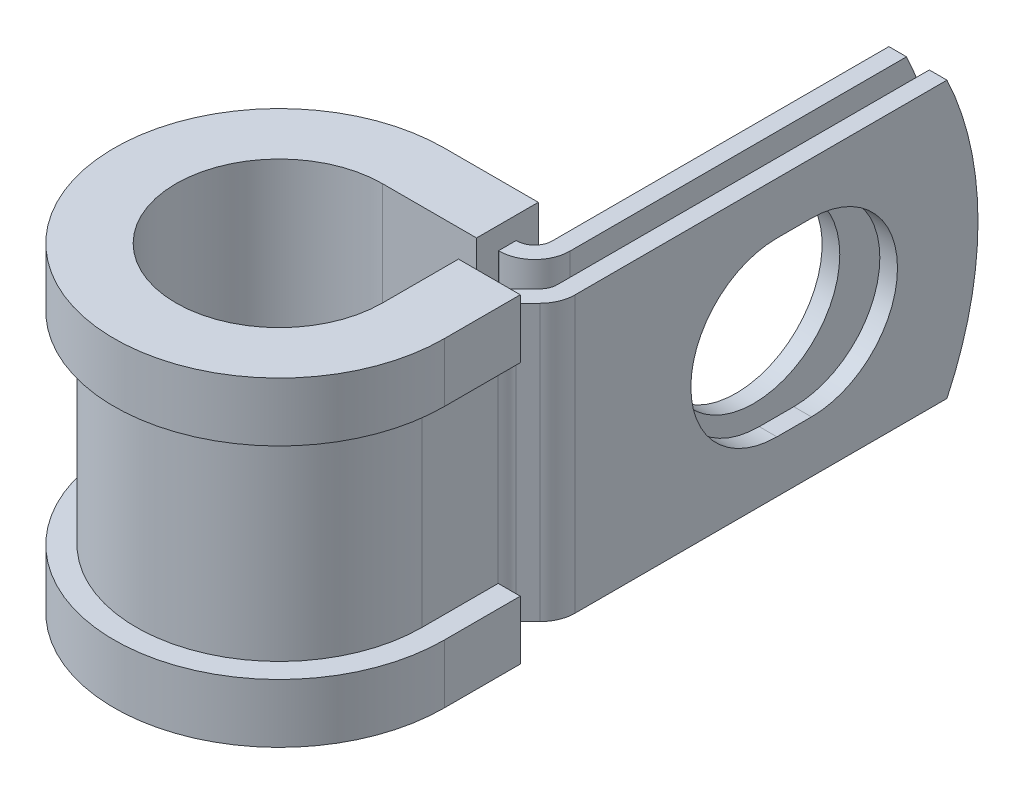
SolidWorks part; units mm, degrees
ref_plane "Front Plane" through (0, 0, 0) normal (0, 0, 1) x (1, 0, 0)
ref_plane "Top Plane" through (0, 0, 0) normal (0, 1, 0) x (1, 0, 0)
ref_plane "Right Plane" through (0, 0, 0) normal (1, 0, 0) x (0, 0, -1)
sketch "Sketch1" plane through (0, 0, 0) normal (0, 1, 0) x (1, 0, 0)
  line L0 (0, 8.6614) -> (6.5457, 8.6614)
  line L1 (8.6614, 0) -> (8.6614, 5.2489)
  line L2 (8.9841, 36.4998) -> (8.9841, 11.0998)
  line L3 (9.3756, 6.9731) -> (10.2018, 7.7993)
  line L5 (10.5589, 8.6614) -> (10.5589, 36.4998)
  arc A0 (0, 8.6614) -> (8.6614, 0) centre (0, 0) ccw
  arc A1 (9.3756, 6.9731) -> (8.6614, 5.2489) centre (11.0998, 5.2489) ccw
  arc A2 (10.2018, 7.7993) -> (10.5589, 8.6614) centre (9.3397, 8.6614) ccw
  arc A3 (6.5457, 8.6614) -> (8.9841, 11.0998) centre (6.5457, 11.0998) ccw
extrude "Extrude-Thin1" add sketch "Sketch1" along normal mid plane 19.05 thin
sketch "Sketch2" plane through (7.7649, 0, 0) normal (-1, 0, 0) x (0, 0, 1)
  line L0 (-36.4998, 9.525) -> (-36.4998, -9.525) construction
  line L1 (0, 9.525) -> (0, -9.525) construction
  circle A0 centre (-23.7998, 0) radius 5.9436
  point P2 (-36.4998, 0)
extrude "Cut-Extrude1" cut sketch "Sketch2" against normal up to surface (1.2192 mm away)
sketch "Sketch3" plane through (11.7781, 0, 0) normal (1, 0, 0) x (0, 0, -1)
  line L0 (22.606, 0) -> (24.9936, 0) construction
  line L1 (22.606, 5.9436) -> (24.9936, 5.9436)
  line L2 (22.606, -5.9436) -> (24.9936, -5.9436)
  line L3 (36.4998, 9.525) -> (36.4998, -9.525) construction
  arc A0 (22.606, 5.9436) -> (22.606, -5.9436) centre (22.606, 0) ccw
  arc A1 (24.9936, -5.9436) -> (24.9936, 5.9436) centre (24.9936, 0) ccw
  point P3 (23.7998, 0)
  point P8 (36.4998, 0)
  point P11 (16.6624, 0)
  point P12 (30.9372, 0)
extrude "Cut-Extrude2" cut sketch "Sketch3" against normal up to surface (1.2192 mm away)
sketch "Sketch4" plane through (7.7649, 0, 0) normal (-1, 0, 0) x (0, 0, 1)
  line L0 (-36.4998, 9.525) -> (-36.4998, -9.525)
  line L1 (-36.4998, 9.525) -> (-34.3553, 9.525)
  line L2 (-36.4998, 9.525) -> (-11.0998, 9.525) construction
  line L3 (-36.4998, -9.525) -> (-34.3553, -9.525)
  line L4 (-36.4998, -9.525) -> (-11.0998, -9.525) construction
  arc A0 (-34.3553, 9.525) -> (-34.3553, -9.525) centre (-14.2748, 0) ccw
extrude "Cut-Extrude3" cut sketch "Sketch4" against normal through all contours A0 M4 M5 | A0 L0 M2
ref_plane "Plane1" through (0, 0, -5.2489) normal (0, 0, -1) x (-1, 0, 0)
ref_plane "Plane2" through (6.4949, 0, 0) normal (-1, 0, 0) x (0, 0, 1)
sketch "Sketch5" plane through (0, 0, -5.2489) normal (0, 0, -1) x (-1, 0, 0)
  line L0 (-9.8806, 9.525) -> (-8.6614, 9.525)
  line L1 (-9.8806, 9.525) -> (-9.8806, -9.525) construction
  line L3 (-8.6614, 9.525) -> (-8.6614, -9.525)
  line L4 (-8.6614, -9.525) -> (-9.8806, -9.525)
  line L5 (-9.8806, -9.525) -> (-9.8806, -6.985)
  line L6 (-9.8806, 9.525) -> (-9.8806, 6.985)
  line L7 (-11.4046, 11.049) -> (-11.4046, 6.985)
  line L8 (-11.4046, 11.049) -> (-7.1374, 11.049)
  line L9 (-7.1374, 11.049) -> (-7.1374, -11.049)
  line L10 (-7.1374, -11.049) -> (-11.4046, -11.049)
  line L11 (-11.4046, -11.049) -> (-11.4046, -6.985)
  line L12 (-11.4046, 6.985) -> (-9.8806, 6.985)
  line L13 (-9.8806, -6.985) -> (-11.4046, -6.985)
sketch "Sketch6" plane through (0, 9.525, 0) normal (0, 1, 0) x (1, 0, 0)
  line L0 (7.1374, 0) -> (7.1374, 5.2489)
  line L1 (7.1374, 5.2489) -> (11.4046, 5.2489) construction
  line L2 (6.4949, 6.9878) -> (6.4949, -6.9878) construction
  line L5 (0, 7.1374) -> (6.4949, 7.1374)
  arc A0 (0, 7.1374) -> (7.1374, 0) centre (0, 0) ccw
sweep "Sweep1" add profiles "Sketch5" path "Sketch6"
equation "\"D4@Sketch5\" = \"D1@Extrude-Thin1\""
equation "\"D5@Sketch5\" = \"D5@Extrude-Thin1\""
equation "\"D1@Sketch3\" = \"D2@Sketch2\""
equation "\"D7@Sketch1\" = \"D3@Sketch2\" + \"D1@Sketch3\""
equation "\"D1@Sketch1\" = \"D1@Sketch6\" + 2 * \"D3@Sketch5\""
equation "\"D1@Sketch4\" = ( \"D1@Extrude-Thin1\" + .125 ) * 2"
equation "\"D9@Sketch1\"= \"D5@Extrude-Thin1\""
equation "\"D8@Sketch1\"= 2 * \"D5@Extrude-Thin1\""
equation "\"D2@Sketch1\" = 2 * \"D5@Extrude-Thin1\""
equation "\"D2@Sketch3\" = \"D1@Sketch2\""
